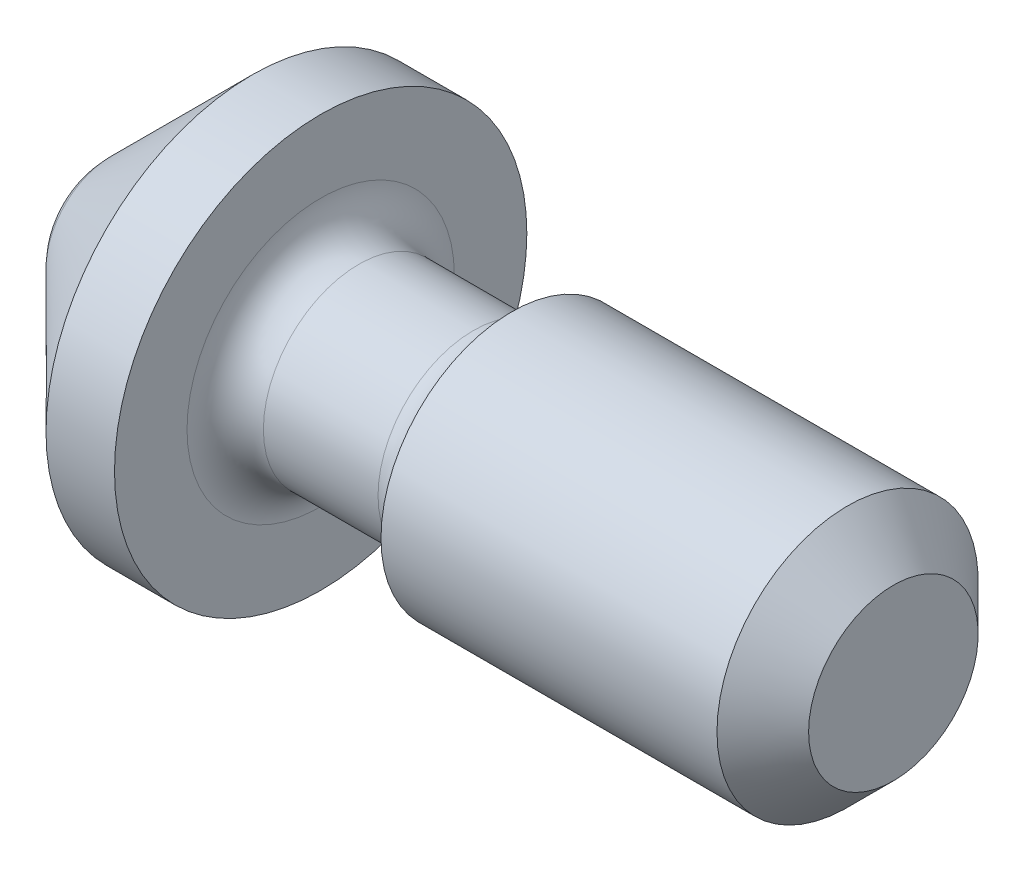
SolidWorks part; units mm, degrees
ref_plane "Front Plane" through (0, 0, 0) normal (0, 0, 1) x (1, 0, 0)
ref_plane "Top Plane" through (0, 0, 0) normal (0, 1, 0) x (1, 0, 0)
ref_plane "Right Plane" through (0, 0, 0) normal (1, 0, 0) x (0, 0, -1)
sketch "Sketch1" plane through (0, 0, 0) normal (0, 0, 1) x (1, 0, 0)
  line L0 (0, 0) -> (13.462, 0)
  line L1 (13.462, 0) -> (13.462, 2.172)
  line L2 (13.462, 2.172) -> (7.112, 2.172)
  line L3 (7.112, 2.172) -> (7.112, 1.588)
  line L4 (7.112, 1.588) -> (3.937, 1.588)
  line L5 (3.937, 1.588) -> (3.937, 3.429)
  line L6 (3.937, 3.429) -> (2.7977, 3.429)
  line L7 (2.7977, 3.429) -> (0.4464, 1.0776)
  arc A0 (0.4464, 1.0776) -> (0, 0) centre (1.524, 0) ccw
  dimension "D8" = 3.048
  dimension "D1" = 13.462
  dimension "D2" = 2.172
  dimension "D3" = 6.35
  dimension "D4" = 9.525
  dimension "D5" = 1.588
  dimension "D6" = 45
  dimension "D7" = 3.429
revolve "Revolve1" add sketch "Sketch1" angle 360 about L0
chamfer "Chamfer1" distance 0.762 angle 45 1 edges at (13.462, 0, 2.172)
fillet "Fillet1" radius 0.635 2 edges at (3.937, 0, 1.588) (7.112, 0, 1.588)
